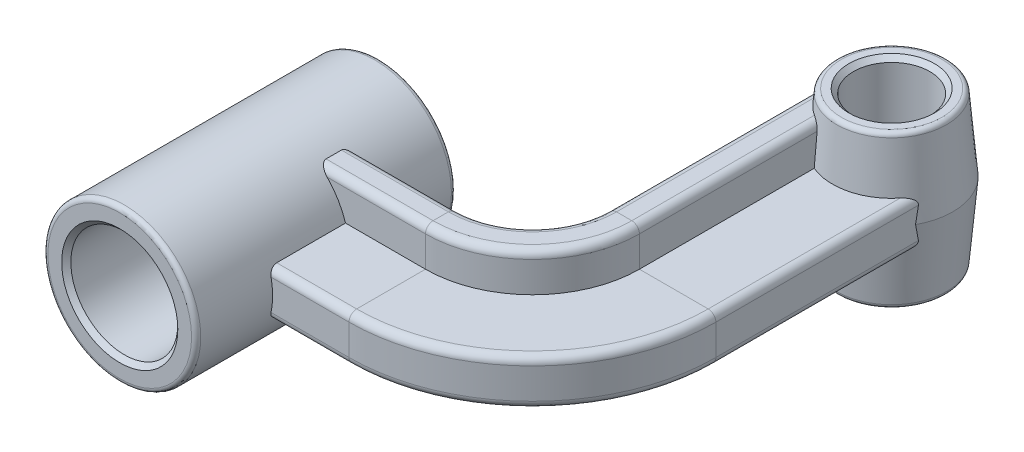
SolidWorks part; units mm, degrees
ref_plane "Front Plane" through (0, 0, 0) normal (0, 0, 1) x (1, 0, 0)
ref_plane "Top Plane" through (0, 0, 0) normal (0, 1, 0) x (1, 0, 0)
ref_plane "Right Plane" through (0, 0, 0) normal (1, 0, 0) x (0, 0, -1)
sketch "Sketch1" plane through (0, 0, 0) normal (0, 0, 1) x (1, 0, 0)
  circle A0 centre (0, 0) radius 50
  dimension "D1" = 100
extrude "Boss-Extrude1" add sketch "Sketch1" along normal blind 120 and the other way blind 50
sketch "Sketch2" plane through (0, 0, 0) normal (1, 0, 0) x (0, 0, -1)
  line L0 (-145.4214, 0) -> (76.9341, 0) construction
  line L1 (-70, 10) -> (-70, -10)
  line L2 (-65, -15) -> (-25, -15)
  line L3 (-20, -20) -> (-20, -35)
  line L4 (-15, -40) -> (-5, -40)
  line L5 (0, -35) -> (0, 35)
  line L6 (-15, 40) -> (-5, 40)
  line L7 (-20, 15) -> (-20, 35)
  line L8 (-65, 15) -> (-20, 15)
  arc A0 (-5, -40) -> (0, -35) centre (-5, -35) ccw
  arc A1 (-20, -35) -> (-15, -40) centre (-15, -35) ccw
  arc A2 (-25, -15) -> (-20, -20) centre (-25, -20) cw
  arc A3 (-70, -10) -> (-65, -15) centre (-65, -10) ccw
  arc A4 (-65, 15) -> (-70, 10) centre (-65, 10) ccw
  arc A5 (-15, 40) -> (-20, 35) centre (-15, 35) ccw
  arc A6 (-5, 40) -> (0, 35) centre (-5, 35) cw
  point P10 (0, 0)
  point P13 (-70, 0)
  point P15 (0, -40)
  point P18 (-20, -40)
  point P21 (-20, -15)
  point P24 (-70, -15)
  point P27 (-70, 15)
  point P30 (-20, 40)
  point P33 (0, 40)
  dimension "D5" = 5
  dimension "D1" = 30
  dimension "D2" = 80
  dimension "D3" = 70
  dimension "D4" = 20
sketch "Sketch3" plane through (0, 0, 0) normal (0, 1, 0) x (1, 0, 0)
  line L0 (0, 0) -> (100, 0)
  line L1 (150, 50) -> (150, 200)
  arc A0 (100, 0) -> (150, 50) centre (100, 50) ccw
  dimension "D3" = 50
  dimension "D1" = 200
  dimension "D2" = 150
sweep "Sweep1" add profiles "Sketch2" path "Sketch3"
sketch "Sketch4" plane through (0, 0, 0) normal (0, 1, 0) x (1, 0, 0)
  line L0 (170, 200) -> (215, 200) construction
  circle A0 centre (185, 200) radius 40
  dimension "D2" = 80
  dimension "D1" = 185
extrude "Boss-Extrude2" add sketch "Sketch4" along normal mid plane 100 draft 5
sketch "Sketch5" plane through (0, 0, 120) normal (0, 0, 1) x (1, 0, 0)
  circle A2 centre (0, 0) radius 35
  circle A3 centre (0, 0) radius 35
  dimension "D1" = 15
extrude "Cut-Extrude1" cut sketch "Sketch5" against normal through all
sketch "Sketch6" plane through (0, 50, 0) normal (0, 1, 0) x (1, 0, 0)
  circle A0 centre (185, 200) radius 25
  dimension "D1" = 50
extrude "Cut-Extrude2" cut sketch "Sketch6" against normal through all
fillet "Fillet1" radius 3 4 edges at (185, -50, -164.3744) (185, 50, -164.3744) (50, 0, -50) (50, 0, 120)
chamfer "Chamfer1" distance 3 angle 45 4 edges at (35, 0, -50) (35, 0, 120) (185, 50, -175) (185, -50, -175)
